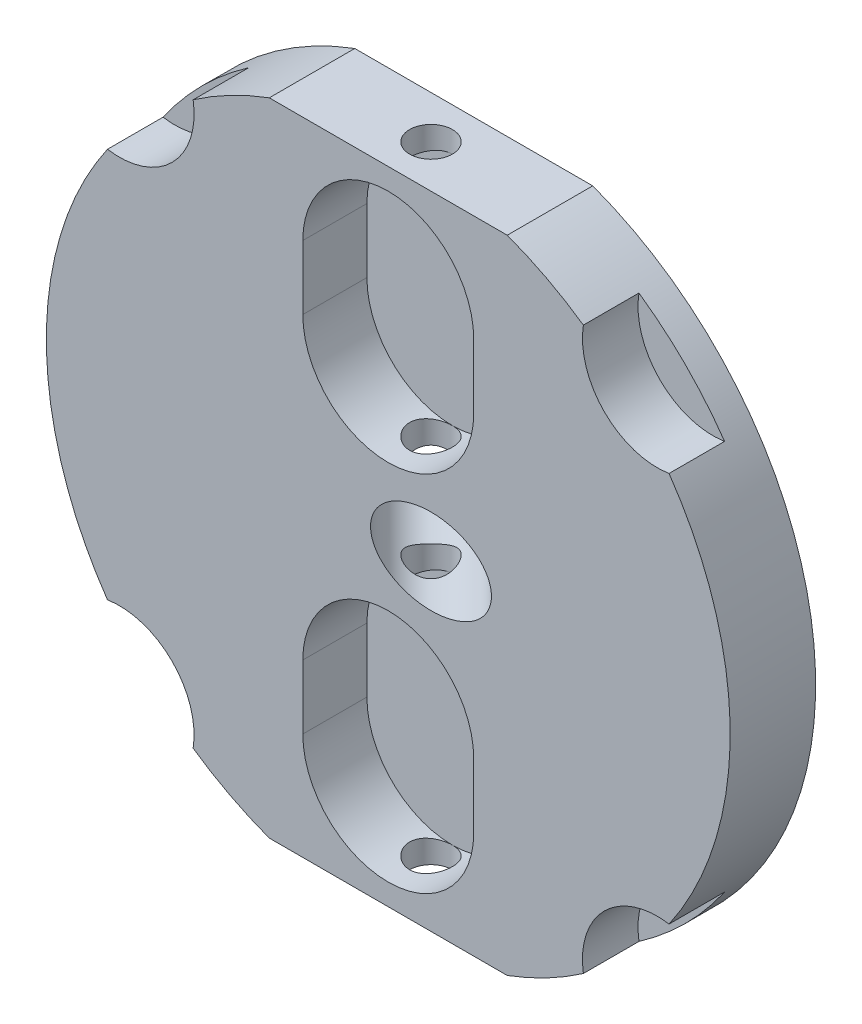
SolidWorks part; units mm, degrees
ref_plane "Plan1" through (0, 0, 0) normal (0, 0, 1) x (1, 0, 0)
ref_plane "Plan2" through (0, 0, 0) normal (0, 1, 0) x (1, 0, 0)
ref_plane "Plan3" through (0, 0, 0) normal (1, 0, 0) x (0, 0, -1)
sketch "Esquisse1" plane through (0, 0, 0) normal (1, 0, 0) x (0, 0, -1)
  line L0 (0, 15.5718) -> (0, 0) construction
  line L1 (0, 0) -> (6.1408, 0) construction
  line L2 (55, 0) -> (-55, 0) construction
  line L5 (-1, 8) -> (1, 8)
  line L6 (-1, 8) -> (-1, 0)
  line L7 (-1, 0) -> (1, 0)
  line L8 (1, 8) -> (1, 0)
  dimension "D1" = 16
  dimension "D2" = 2
revolve "Révolution1" add sketch "Esquisse1" angle 360 about L1
sketch "Esquisse2" plane through (0, 0, 0) normal (0, 1, 0) x (1, 0, 0)
  circle A0 centre (0, 0) radius 0.5
  dimension "D1" = 1
extrude "Enlèv. mat.-Extru.1" cut sketch "Esquisse2" against normal through all and the other way through all
sketch "Esquisse3" plane through (0, 0, 0) normal (0, 0, 1) x (1, 0, 0)
  line L1 (-5.1479, 0) -> (14.2724, 0) construction
  line L2 (55, 0) -> (-55, 0) construction
  line L4 (-14.8409, 7.5) -> (11.2856, 7.5)
  line L5 (-14.8409, 7.5) -> (-14.8409, -7.5)
  line L6 (-14.8409, -7.5) -> (11.2856, -7.5)
  line L7 (11.2856, 7.5) -> (11.2856, -7.5)
  circle A0 centre (0, 0) radius 8 construction
  dimension "D1" = 0.5
extrude "Enlèv. mat.-Extru.2" cut sketch "Esquisse3" against normal mid plane 10 flip side to cut
sketch "Esquisse4" plane through (0, 0, 0) normal (0, 1, 0) x (1, 0, 0)
  line L0 (-4.3187, 4.3187) -> (4.3187, -4.3187) construction
  line L1 (0, -1.1) -> (0, 1.1) construction
  line L2 (-2.6479, 2.6479) -> (3.1547, -3.1547)
  line L3 (-2.6479, 2.6479) -> (-1.9408, 3.355)
  line L4 (3.1547, -3.1547) -> (3.8618, -2.4476)
  line L5 (-1.9408, 3.355) -> (3.8618, -2.4476)
  dimension "D1" = 45
  dimension "D2" = 2
revolve "Enlèvement de matière-Révolution1" cut sketch "Esquisse4" angle 360 about L0
ref_plane "Plan4" through (0, 0, 0) normal (-0.7071, 0, -0.7071) x (-0.7071, 0, 0.7071)
sketch "Esquisse6" plane through (0, 0, 1) normal (0, 0, 1) x (1, 0, 0)
  line L0 (0, 5) -> (0, 3.5) construction
  line L1 (0, 0.9351) -> (0, 7.5) construction
  line L2 (2, 5) -> (2, 3.5)
  line L3 (-2, 5) -> (-2, 3.5)
  line L4 (-2.7839, 7.5) -> (2.7839, 7.5) construction
  arc A0 (2, 5) -> (-2, 5) centre (0, 5) ccw
  arc A1 (-2, 3.5) -> (2, 3.5) centre (0, 3.5) ccw
  point P5 (0, 4.25)
  dimension "D1" = 0.5
  dimension "D3" = 4
extrude "Enlèv. mat.-Extru.4" cut sketch "Esquisse6" against normal blind 1.5
mirror "Symétrie1" about plane through (0, 0, 0) normal (0, 1, 0) of "Enlèv. mat.-Extru.4"
sketch "Esquisse7" plane through (0, 0, 1) normal (0, 0, 1) x (1, 0, 0)
  line L0 (-6.2933, 6.2933) -> (0, 0) construction
  line L1 (0, -1.1) -> (0, 1.1) construction
  circle A0 centre (-6.2933, 6.2933) radius 1.75
  circle A1 centre (-6.2933, 6.2933) radius 0.8 construction
  arc A2 (-2.7839, 7.5) -> (-2.7839, -7.5) centre (0, 0) ccw construction
  dimension "D1" = 45
  dimension "D3" = 3.5
  dimension "D4" = 1.6
  dimension "D5" = 0.1
  dimension "D2" = 8.9
extrude "Enlèv. mat.-Extru.5" cut sketch "Esquisse7" against normal blind 1.3
pattern_circular "Répétition circulaire1" count 4 over 360 about axis through (0, 0, 0) along (0, 0, 1) of "Enlèv. mat.-Extru.5"
